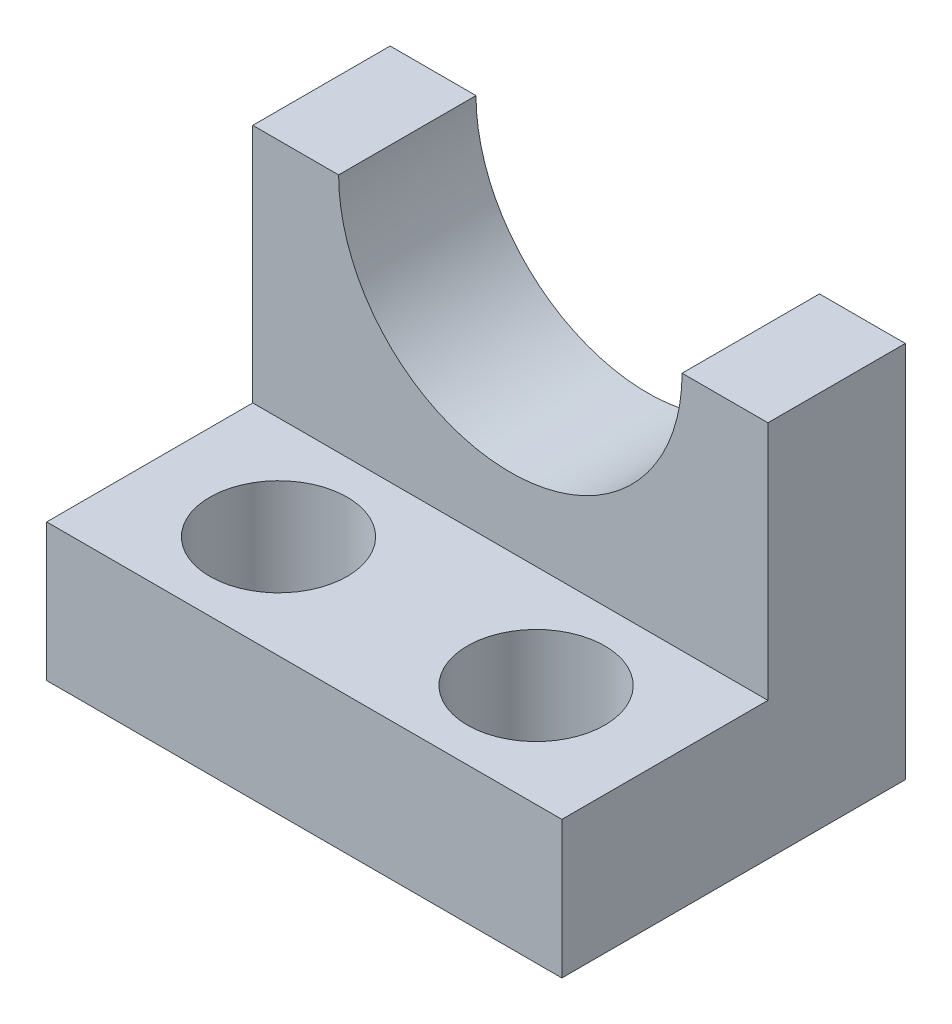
SolidWorks part; units mm, degrees
ref_plane "前视基准面" through (0, 0, 0) normal (0, 0, 1) x (1, 0, 0)
ref_plane "上视基准面" through (0, 0, 0) normal (0, 1, 0) x (1, 0, 0)
ref_plane "右视基准面" through (0, 0, 0) normal (1, 0, 0) x (0, 0, -1)
sketch "草图1" plane through (0, 0, 0) normal (0, 1, 0) x (1, 0, 0)
  line L1 (0, 0) -> (30, 0)
  line L2 (0, 0) -> (0, 20)
  line L3 (0, 20) -> (30, 20)
  line L4 (30, 0) -> (30, 20)
  dimension "D1" = 30
  dimension "D2" = 20
extrude "拉伸1" add sketch "草图1" along normal blind 8
sketch "草图2" plane through (0, 8, 0) normal (0, 1, 0) x (1, 0, 0)
  line L0 (30, 0) -> (30, 20) construction
  line L1 (0, 20) -> (30, 20)
  line L2 (0, 20) -> (0, 12)
  line L3 (0, 12) -> (30, 12)
  line L4 (30, 20) -> (30, 12)
  dimension "D1" = 8
extrude "拉伸2" add sketch "草图2" along normal blind 14
sketch "草图3" plane through (0, 8, 0) normal (0, 1, 0) x (1, 0, 0)
  line L1 (0, 0) -> (30, 0) construction
  line L2 (15, 0) -> (15, -4.5054) construction
  circle A0 centre (7.5, 6) radius 4
  circle A1 centre (22.5, 6) radius 4
  dimension "D1" = 15
  dimension "D3" = 8
  dimension "D2" = 6
extrude "切除-拉伸1" cut sketch "草图3" against normal through all
sketch "草图4" plane through (0, 0, -12) normal (0, 0, 1) x (1, 0, 0)
  line L0 (0, 22) -> (30, 22) construction
  circle A0 centre (15, 22) radius 10
  dimension "D1" = 20
extrude "切除-拉伸2" cut sketch "草图4" against normal through all
